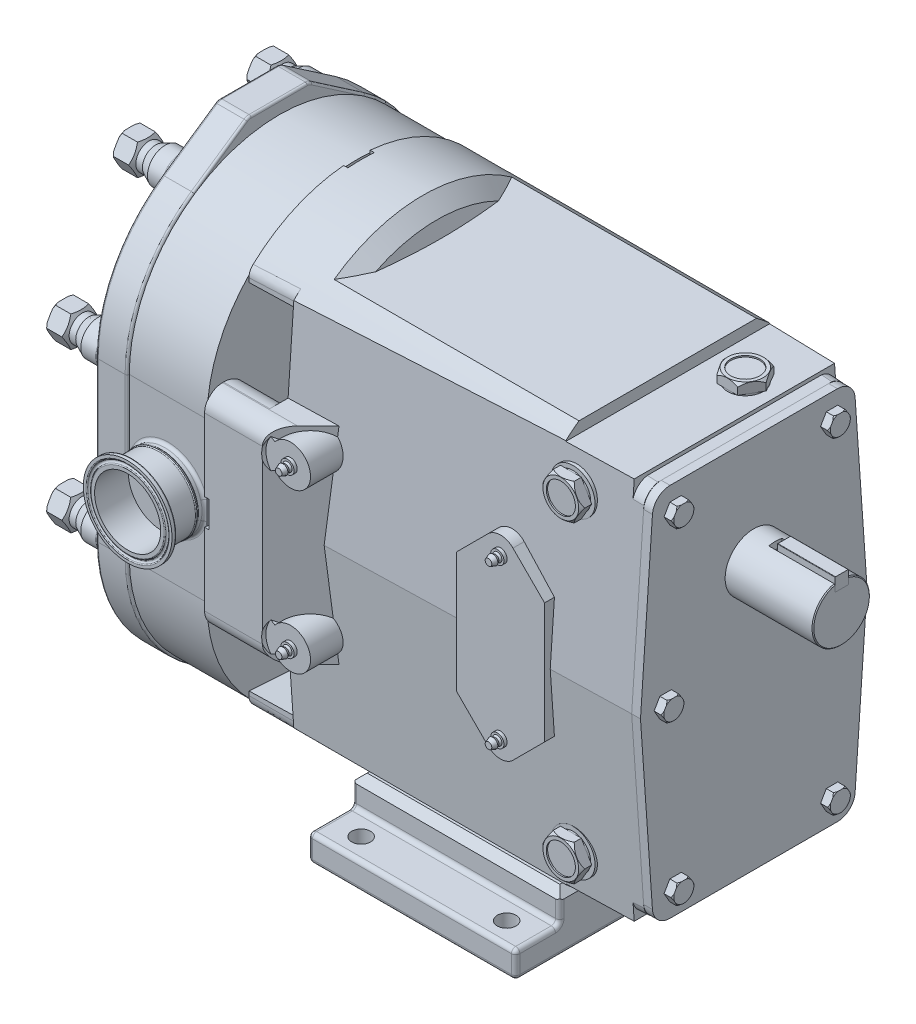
SolidWorks part; units mm, degrees
ref_plane "Front Plane" through (0, 0, 0) normal (0, 0, 1) x (1, 0, 0)
ref_plane "Top Plane" through (0, 0, 0) normal (0, 1, 0) x (1, 0, 0)
ref_plane "Right Plane" through (0, 0, 0) normal (1, 0, 0) x (0, 0, -1)
other "Join1"
other "Shaft_060<1>@045_U2_Upper Shaft"
other "plate_060<1>@045_U2_Upper Shaft"
other "108371<5>@045_U2_Upper Shaft"
other "108371<1>@045_U2_Upper Shaft"
other "101848<1>@045_U2_Upper Shaft"
other "107233<1>@045_U2_Upper Shaft"
other "070110000<1>@045_U2_Upper Shaft"
other "070005000<1>@045_U2_Upper Shaft"
other "grease fitting<4>@045_U2_Upper Shaft"
other "grease fitting<2>@045_U2_Upper Shaft"
other "cleanout plug<2>@045_U2_Upper Shaft"
other "oil plug<4>@045_U2_Upper Shaft"
other "oil plug<2>@045_U2_Upper Shaft"
other "108371<8>@045_U2_Upper Shaft"
other "108371<7>@045_U2_Upper Shaft"
other "108371<6>@045_U2_Upper Shaft"
other "108371<4>@045_U2_Upper Shaft"
other "108371<3>@045_U2_Upper Shaft"
other "108371<2>@045_U2_Upper Shaft"
other "Key_060<1>@045_U2_Upper Shaft"
other "grease fitting<3>@045_U2_Upper Shaft"
other "grease fitting<1>@045_U2_Upper Shaft"
other "oil plug<6>@045_U2_Upper Shaft"
other "oil plug<5>@045_U2_Upper Shaft"
other "cleanout plug<1>@045_U2_Upper Shaft"
other "oil plug<3>@045_U2_Upper Shaft"
other "oil plug<1>@045_U2_Upper Shaft"
other "CD0360006<2>@045_U2_Upper Shaft"
other "CD0360006<1>@045_U2_Upper Shaft"
